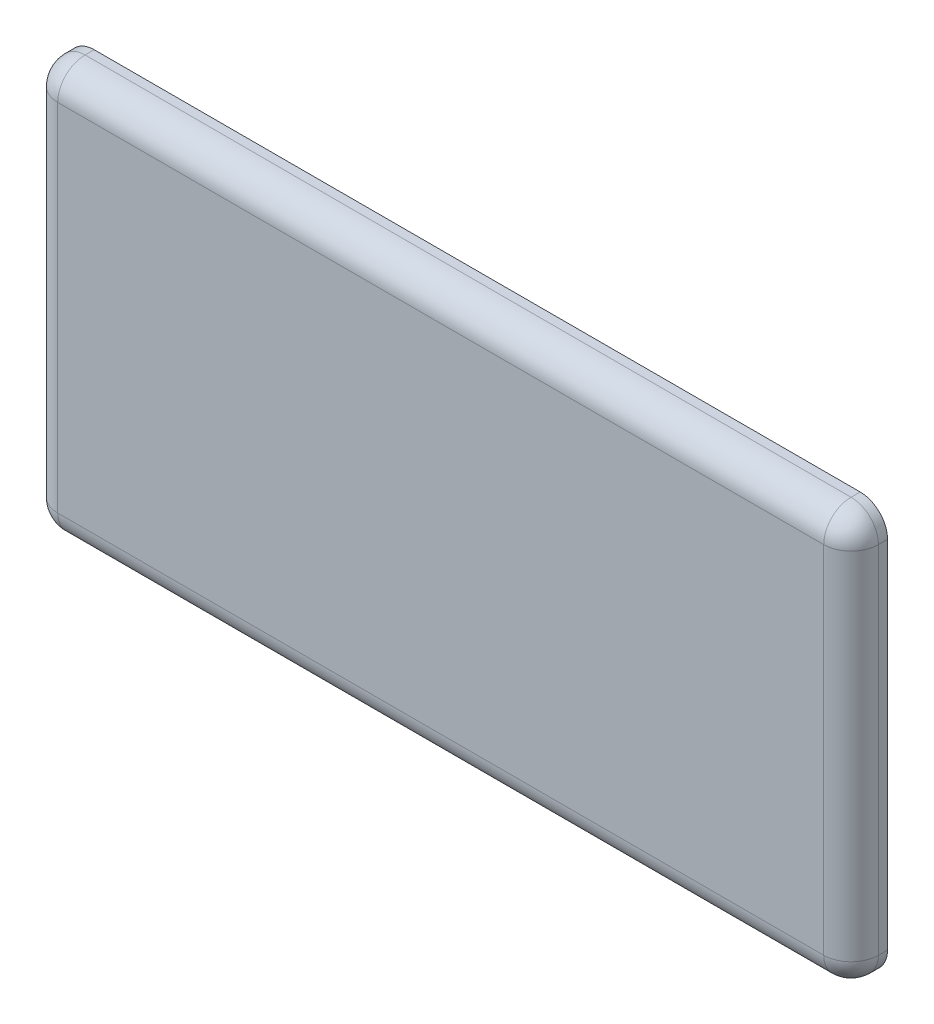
SolidWorks part; units mm, degrees
ref_plane "Front Plane" through (0, 0, 0) normal (0, 0, 1) x (1, 0, 0)
ref_plane "Top Plane" through (0, 0, 0) normal (0, 1, 0) x (1, 0, 0)
ref_plane "Right Plane" through (0, 0, 0) normal (1, 0, 0) x (0, 0, -1)
sketch "Sketch1" plane through (0, 0, 0) normal (0, 0, 1) x (1, 0, 0)
  line L0 (-45, 0) -> (45, 0) construction
  line L1 (-45, 22.5) -> (45, 22.5)
  line L2 (-45, 22.5) -> (-45, -22.5)
  line L3 (-45, -22.5) -> (45, -22.5)
  line L4 (45, 22.5) -> (45, -22.5)
  line L5 (0, 22.5) -> (0, -22.5) construction
  dimension "D1" = 45
  dimension "D2" = 90
extrude "Boss-Extrude1" add sketch "Sketch1" along normal blind 4
fillet "Fillet1" radius 3 4 edges at (-45, -22.5, 2) (45, -22.5, 2) (45, 22.5, 2) (-45, 22.5, 2)
fillet "Fillet2" radius 3 8 edges at (-44.1213, 21.6213, 4) (0, 22.5, 4) (44.1213, 21.6213, 4) (45, 0, 4) (44.1213, -21.6213, 4) (0, -22.5, 4) (-44.1213, -21.6213, 4) (-45, 0, 4)
sketch "Sketch2" plane through (0, 0, 0) normal (0, 0, -1) x (-1, 0, 0)
  line L1 (37, -17) -> (-37, -17)
  line L2 (37, -17) -> (37, 17)
  line L3 (37, 17) -> (-37, 17)
  line L4 (-37, -17) -> (-37, 17)
  line L5 (37, -17) -> (-37, 17) construction
  line L6 (37, 17) -> (-37, -17) construction
  point P0 (0, 0)
  dimension "D1" = 74
  dimension "D2" = 34
extrude "Cut-Extrude1" cut sketch "Sketch2" against normal blind 1
sketch "Sketch3" plane through (0, 0, 0) normal (0, 1, 0) x (0, 0, -1)
  line L0 (0, -37) -> (3, -38.0919)
  line L2 (3, -38.0919) -> (3, -39.7)
  line L3 (3, -39.7) -> (0, -39.7)
  line L4 (0, -39.7) -> (0, -37)
  dimension "D1" = 2.7
  dimension "D2" = 3
  dimension "D3" = 110
extrude "Boss-Extrude2" add sketch "Sketch3" along normal mid plane 9.8
fillet "Fillet3" radius 1 2 edges at (38.896, -4.9, -3) (38.896, 4.9, -3)
sketch "Sketch4" plane through (0, 0, 1) normal (0, 0, -1) x (-1, 0, 0)
  line L0 (-22.5, 3.45) -> (-22.5, -3.45) construction
  line L1 (-25.95, 0) -> (-19.05, 0) construction
  line L2 (-25.8019, -1) -> (-23.5, -1)
  line L3 (-23.5, 3.3019) -> (-23.5, 1)
  line L4 (-25.8019, 1) -> (-23.5, 1)
  line L5 (-21.5, 3.3019) -> (-21.5, 1)
  line L6 (-23.5, -1) -> (-23.5, -3.3019)
  line L7 (-21.5, -1) -> (-19.1981, -1)
  line L8 (-23.5, 3.45) -> (-23.5, -3.45) construction
  line L9 (-21.5, 1) -> (-19.1981, 1)
  line L10 (-2.3, -1) -> (2.3, -1) construction
  line L11 (-21.5, -1) -> (-21.5, -3.3019)
  line L12 (-2.3, 1) -> (2.3, 1) construction
  line L13 (-2.3, 0) -> (2.3, 0) construction
  line L14 (-21.5, 3.45) -> (-21.5, -3.45) construction
  line L15 (-22.5, 0) -> (22.5, 0) construction
  arc A0 (-25.8019, 1) -> (-25.8019, -1) centre (-22.5, 0) ccw
  arc A1 (-21.5, 3.3019) -> (-23.5, 3.3019) centre (-22.5, 0) ccw
  arc A2 (-19.1981, -1) -> (-19.1981, 1) centre (-22.5, 0) ccw
  arc A3 (-23.5, -3.3019) -> (-21.5, -3.3019) centre (-22.5, 0) ccw
  dimension "D1" = 6.9
  dimension "D4" = 45
  dimension "D2" = 1
  dimension "D3" = 1
extrude "Boss-Extrude3" add sketch "Sketch4" along normal blind 9.5
sketch "Sketch5" plane through (0, 0, 0) normal (0, 1, 0) x (0, 0, -1)
  line L0 (-1, -22.5) -> (8.5, -22.5) construction
  line L1 (8.5, -23.5) -> (8.5, -21.5) construction
  line L2 (5.5, -19.05) -> (8.5, -19.05)
  line L3 (8.5, -19.05) -> (8.5, -19.9985)
  line L6 (5.5, -19.05) -> (8.0868, -19.5061)
  arc A0 (8.0868, -19.5061) -> (8.5, -19.9985) centre (8, -19.9985) cw
  dimension "D1" = 3
  dimension "D2" = 0.5
  dimension "D3" = 10
revolve "Cut-Revolve1" cut sketch "Sketch5" angle 360 about L0
pattern_linear "LPattern1" count 2 spacing 45 along (-1, 0, 0) of "Boss-Extrude3", "Cut-Revolve1"
